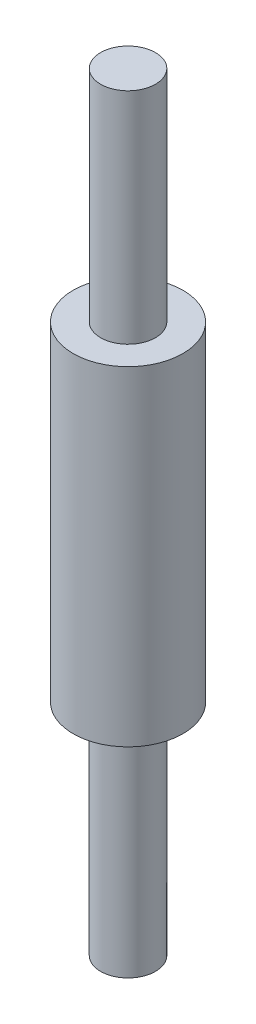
SolidWorks part; units mm, degrees
ref_plane "Front Plane" through (0, 0, 0) normal (0, 0, 1) x (1, 0, 0)
ref_plane "Top Plane" through (0, 0, 0) normal (0, 1, 0) x (1, 0, 0)
ref_plane "Right Plane" through (0, 0, 0) normal (1, 0, 0) x (0, 0, -1)
sketch "Sketch1" plane through (0, 0, 0) normal (0, 1, 0) x (1, 0, 0)
  circle A0 centre (0, 0) radius 6.35
  dimension "D1" = 12.7
extrude "Boss-Extrude1" add sketch "Sketch1" along normal blind 88.9
sketch "Sketch2" plane through (0, 0, 0) normal (0, -1, 0) x (1, 0, 0)
  circle A0 centre (0, 0) radius 3.175
  dimension "D1" = 6.35
extrude "Cut-Extrude1" cut sketch "Sketch2" against normal blind 25.4 flip side to cut
sketch "Sketch3" plane through (0, 88.9, 0) normal (0, 1, 0) x (1, 0, 0)
  circle A0 centre (0, 0) radius 3.175
  circle A1 centre (0, 0) radius 3.175 construction
extrude "Cut-Extrude2" cut sketch "Sketch3" against normal blind 25.4 flip side to cut
